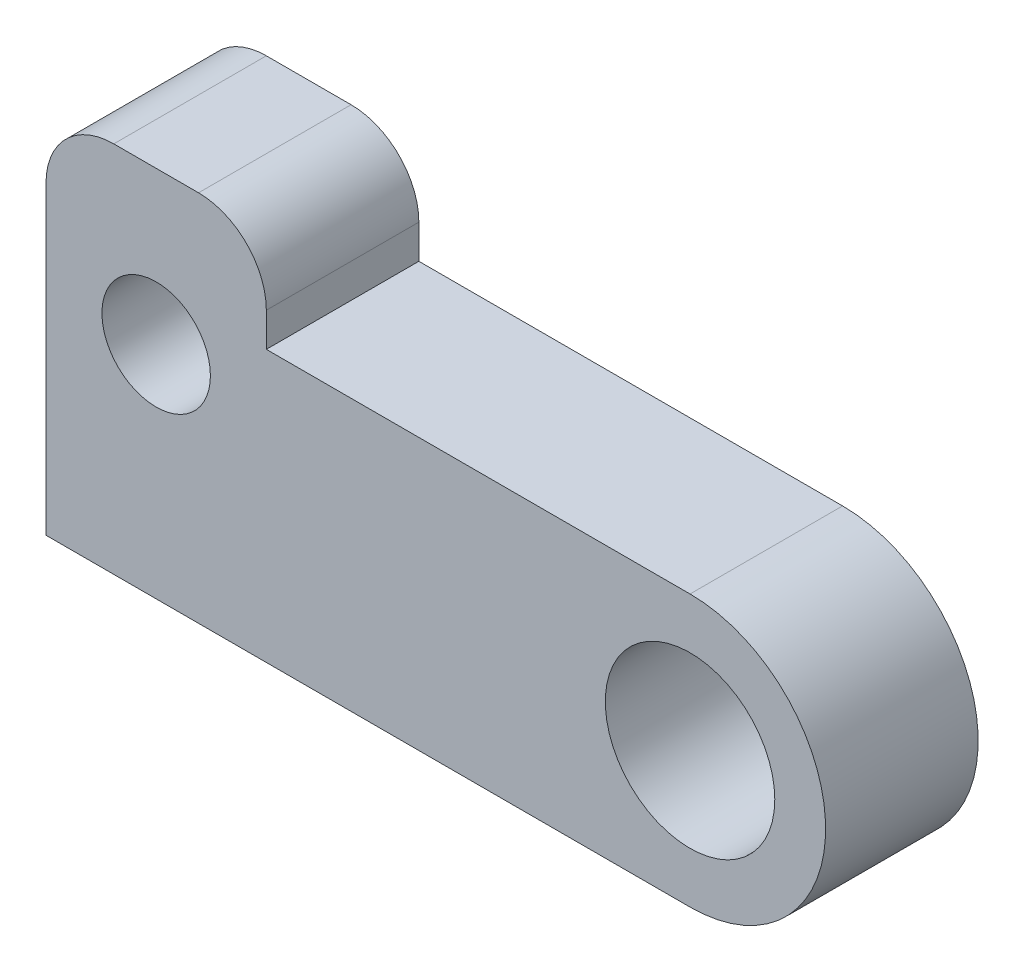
SolidWorks part; units mm, degrees
ref_plane "Alzado" through (0, 0, 0) normal (0, 0, 1) x (1, 0, 0)
ref_plane "Planta" through (0, 0, 0) normal (0, 1, 0) x (1, 0, 0)
ref_plane "Vista lateral" through (0, 0, 0) normal (1, 0, 0) x (0, 0, -1)
sketch "Croquis1" plane through (0, 0, 0) normal (0, 0, 1) x (1, 0, 0)
  line L0 (2, 0) -> (4.5, 0)
  line L1 (6.5, -2) -> (6.5, -3)
  line L2 (0, -2) -> (0, -11)
  line L3 (0, -11) -> (19, -11)
  line L5 (6.5, -3) -> (19, -3)
  arc A0 (19, -11) -> (19, -3) centre (19, -7) ccw
  arc A1 (6.5, -2) -> (4.5, 0) centre (4.5, -2) ccw
  arc A2 (2, 0) -> (0, -2) centre (2, -2) ccw
  circle A3 centre (19, -7) radius 2.5
  circle A4 centre (3.25, -4.5) radius 1.6
  point P12 (0, 0)
  dimension "D3" = 2
  dimension "D4" = 4.5
  dimension "D1" = 11
  dimension "D2" = 19
extrude "Saliente-Extruir1" add sketch "Croquis1" along normal blind 4.5
